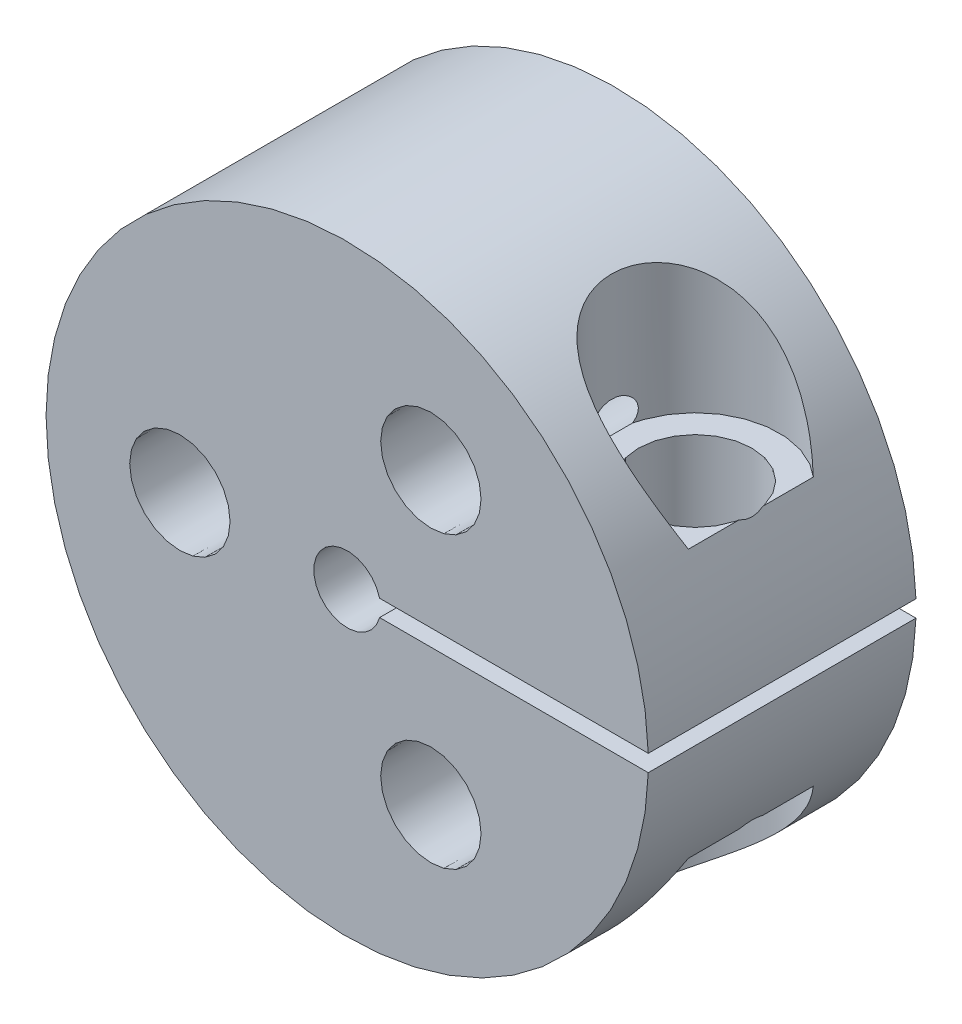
SolidWorks part; units mm, degrees
ref_plane "Front Plane" through (0, 0, 0) normal (0, 0, 1) x (1, 0, 0)
ref_plane "Top Plane" through (0, 0, 0) normal (0, 1, 0) x (1, 0, 0)
ref_plane "Right Plane" through (0, 0, 0) normal (1, 0, 0) x (0, 0, -1)
sketch "Sketch1" plane through (0, 0, 0) normal (0, 0, 1) x (1, 0, 0)
  line L0 (0, 0) -> (5.5204, 9.5617) construction
  line L1 (0, 0) -> (-7.7529, 0) construction
  line L2 (0, 0) -> (4.7704, -8.2626) construction
  line L3 (55, 0) -> (-55, 0) construction
  line L4 (0, -0.25) -> (8.9965, -0.25)
  line L5 (0, -0.25) -> (0, 0.25)
  line L6 (0, 0.25) -> (8.9965, 0.25)
  line L8 (0, -55) -> (0, 55) construction
  arc A0 (8.9965, 0.25) -> (8.9965, -0.25) centre (0, 0) ccw
  circle A1 centre (0, 0) radius 1
  circle A2 centre (2.5, 4.3301) radius 1.5
  circle A3 centre (2.5, -4.3301) radius 1.5
  circle A4 centre (-5, 0) radius 1.5
  circle A5 centre (0, 0) radius 5 construction
  point P14 (0, 0)
  dimension "D1" = 2
  dimension "D2" = 18
  dimension "D5" = 3
  dimension "D6" = 10
  dimension "D3" = 120
  dimension "D4" = 120
  dimension "D7" = 0.5
extrude "Boss-Extrude1" add sketch "Sketch1" along normal mid plane 8 contours A1 L6 A0 L4 A4 A3 A2
sketch "Sketch2" plane through (0, 0, 0) normal (0, 1, 0) x (1, 0, 0)
  line L0 (-9.8981, 0) -> (9.8981, 0) construction
  line L1 (0, -4.4) -> (0, 4.4) construction
  circle A0 centre (6.4, 0) radius 1.7
  point P2 (0, 0)
  point P5 (6.5922, 0)
  dimension "D1" = 3.4
  dimension "D2" = 6.4
extrude "Cut-Extrude1" cut sketch "Sketch2" against normal through all both and the other way through all contours A0
ref_plane "Plane1" through (0, 4, 0) normal (0, 1, 0) x (1, 0, 0)
sketch "Sketch3" plane through (0, 4, 0) normal (0, 1, 0) x (1, 0, 0)
  circle A0 centre (6.4, 0) radius 2.5
  dimension "D1" = 5
extrude "Cut-Extrude2" cut sketch "Sketch3" along normal through all
mirror "Mirror1" about plane through (0, 0, 0) normal (0, 1, 0) of "Cut-Extrude2"
